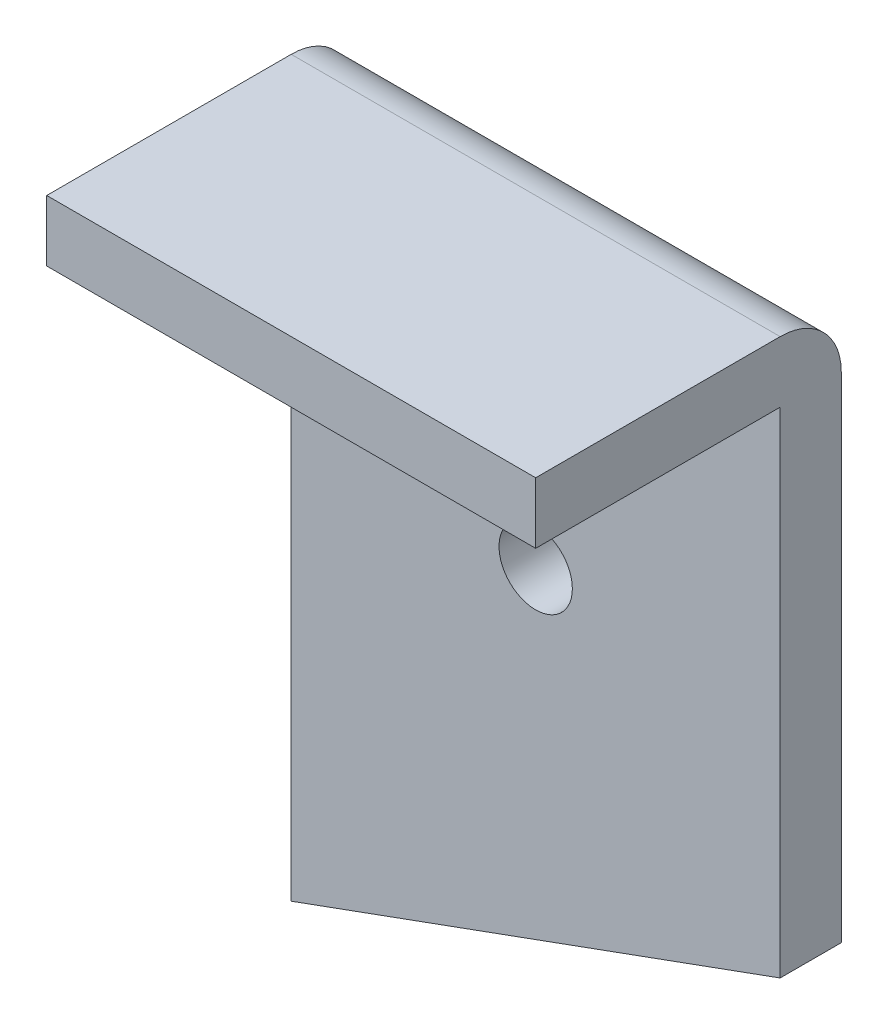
SolidWorks part; units mm, degrees
ref_plane "Plan de face" through (0, 0, 0) normal (0, 0, 1) x (1, 0, 0)
ref_plane "Plan de dessus" through (0, 0, 0) normal (0, 1, 0) x (1, 0, 0)
ref_plane "Plan de droite" through (0, 0, 0) normal (1, 0, 0) x (0, 0, -1)
sketch "Esquisse1" plane through (0, 0, 0) normal (0, 0, 1) x (1, 0, 0)
  line L0 (0, 0) -> (80, 0)
  line L1 (0, 0) -> (0, -120)
  line L2 (0, -120) -> (80, -90.8824)
  line L3 (80, 0) -> (80, -90.8824)
  line L6 (40, 0) -> (40, -111.8747) construction
  line L7 (0, -60) -> (80, -45.4412) construction
  circle A0 centre (40, -52.7206) radius 6
  dimension "D4" = 12
  dimension "D1" = 80
  dimension "D2" = 120
  dimension "D3" = 110
extrude "Extrusion1" add sketch "Esquisse1" along normal blind 10
sketch "Esquisse2" plane through (0, 0, 10) normal (0, 0, 1) x (1, 0, 0)
  line L0 (80, -90.8824) -> (80, 0) construction
  line L1 (0, 0) -> (80, 0)
  line L2 (0, 0) -> (0, -10)
  line L3 (0, -10) -> (80, -10)
  line L4 (80, 0) -> (80, -10)
  dimension "D1" = 10
extrude "Extrusion2" add sketch "Esquisse2" along normal blind 40
fillet "Congé1" radius 10 1 edges at (40, 0, 0)
